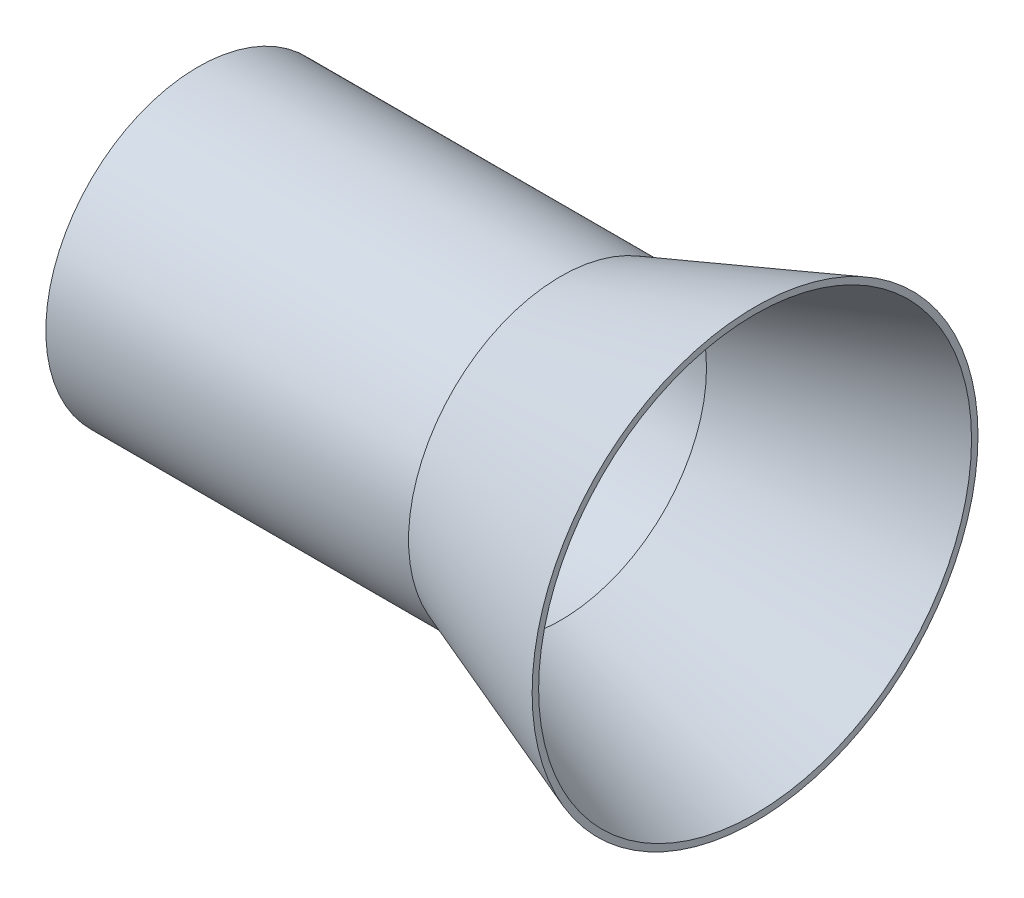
SolidWorks part; units mm, degrees
ref_plane "前视基准面" through (0, 0, 0) normal (0, 0, 1) x (1, 0, 0)
ref_plane "上视基准面" through (0, 0, 0) normal (0, 1, 0) x (1, 0, 0)
ref_plane "右视基准面" through (0, 0, 0) normal (1, 0, 0) x (0, 0, -1)
sketch "草图1" plane through (0, 0, 0) normal (1, 0, 0) x (0, 0, -1)
  circle A0 centre (0, 0) radius 45
  circle A1 centre (0, 0) radius 47
  dimension "D1" = 90
  dimension "D2" = 94
extrude "凸台-拉伸1" add sketch "草图1" along normal blind 112
sketch "草图2" plane through (0, 0, 0) normal (0, 1, 0) x (1, 0, 0)
  line L1 (112, -47) -> (112, 47) construction
  line L2 (112, -45) -> (172, -66.8382)
  line L3 (172, -66.8382) -> (172, -68.8382)
  line L4 (172, -68.8382) -> (112, -47)
  line L5 (112, 0) -> (172, 0) construction
  line L6 (112, -47) -> (112, -45)
  dimension "D1" = 60
  dimension "D2" = 110
  dimension "D3" = 2
revolve "旋转1" add sketch "草图2" angle 360 about L5
